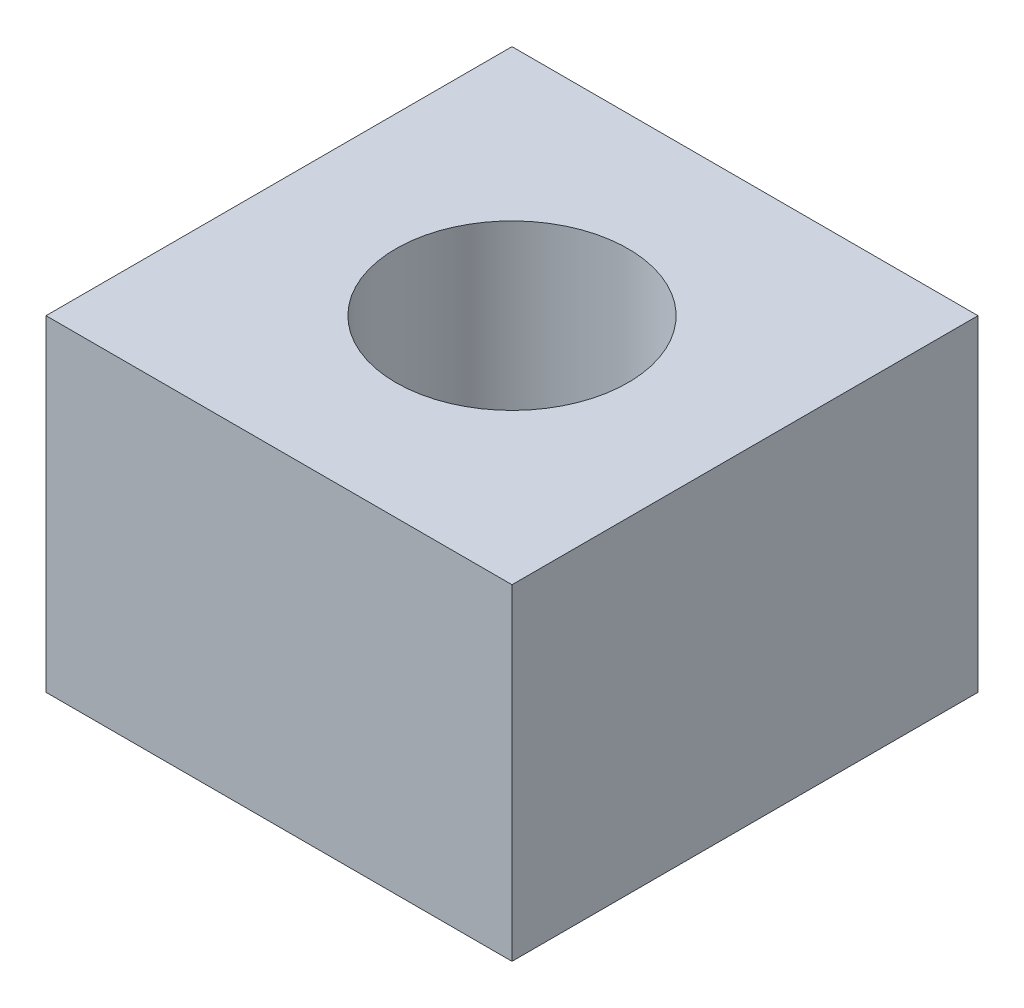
SolidWorks part; units mm, degrees
ref_plane "前视基准面" through (0, 0, 0) normal (0, 0, 1) x (1, 0, 0)
ref_plane "上视基准面" through (0, 0, 0) normal (0, 1, 0) x (1, 0, 0)
ref_plane "右视基准面" through (0, 0, 0) normal (1, 0, 0) x (0, 0, -1)
sketch "草图1" plane through (0, 0, 0) normal (0, 1, 0) x (1, 0, 0)
  line L1 (-104.3478, 83.1522) -> (95.6522, 83.1522)
  line L2 (-104.3478, 83.1522) -> (-104.3478, -116.8478)
  line L3 (-104.3478, -116.8478) -> (95.6522, -116.8478)
  line L4 (95.6522, 83.1522) -> (95.6522, -116.8478)
  circle A0 centre (-4.3478, -16.8478) radius 49.8167
  point P8 (-1093.2679, 383.9502)
  dimension "D1" = 200
  dimension "D2" = 200
  dimension "D3" = 100
  dimension "D4" = 100
extrude "凸台-拉伸1" add sketch "草图1" along normal blind 140
